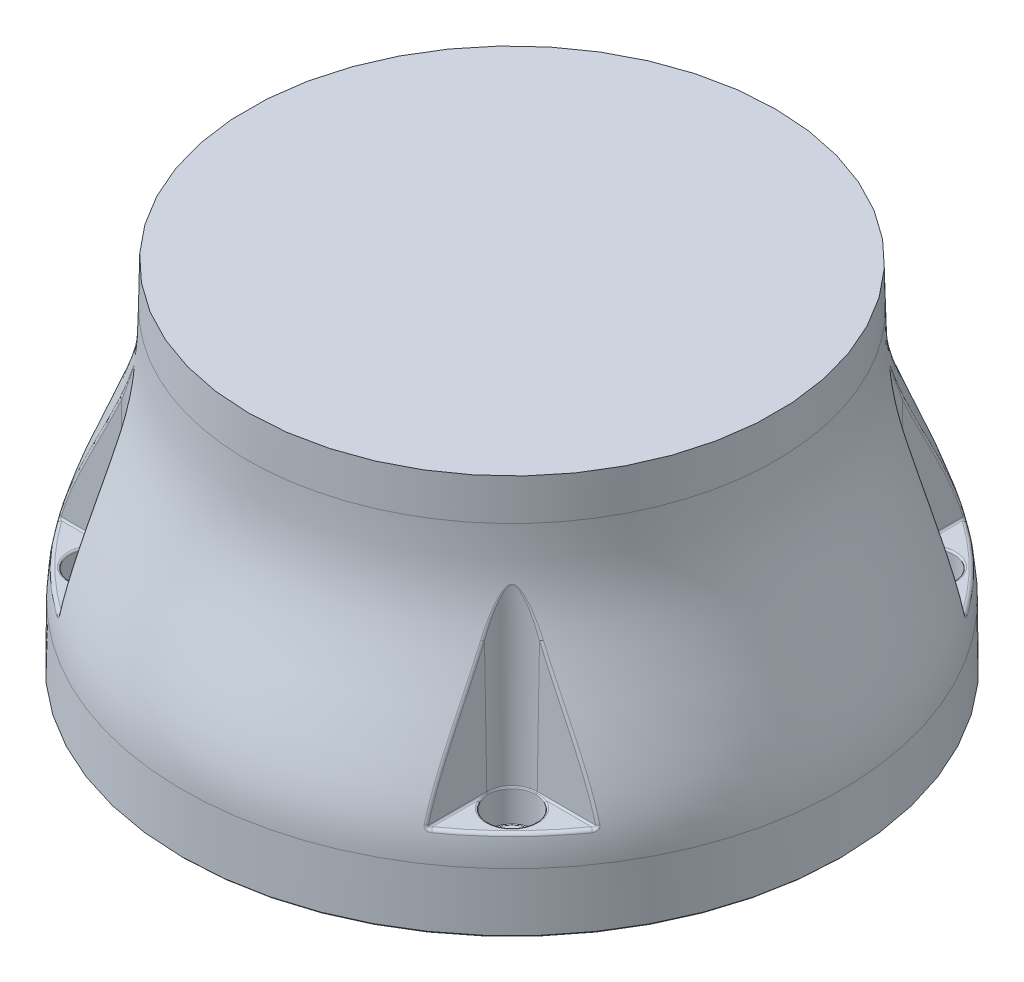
SolidWorks part; units mm, degrees
ref_plane "前视基准面" through (0, 0, 0) normal (0, 0, 1) x (1, 0, 0)
ref_plane "上视基准面" through (0, 0, 0) normal (0, 1, 0) x (1, 0, 0)
ref_plane "右视基准面" through (0, 0, 0) normal (1, 0, 0) x (0, 0, -1)
imported_body "输入1"
sketch "草图1" plane through (0, 101.5, 0) normal (0, 1, 0) x (1, 0, 0)
  circle A2 centre (0, 0) radius 73.7958
  circle A3 centre (0, 0) radius 73.7958
  dimension "D1" = 2
extrude "凸台-拉伸1" add sketch "草图1" against normal up to surface (34 mm away)
